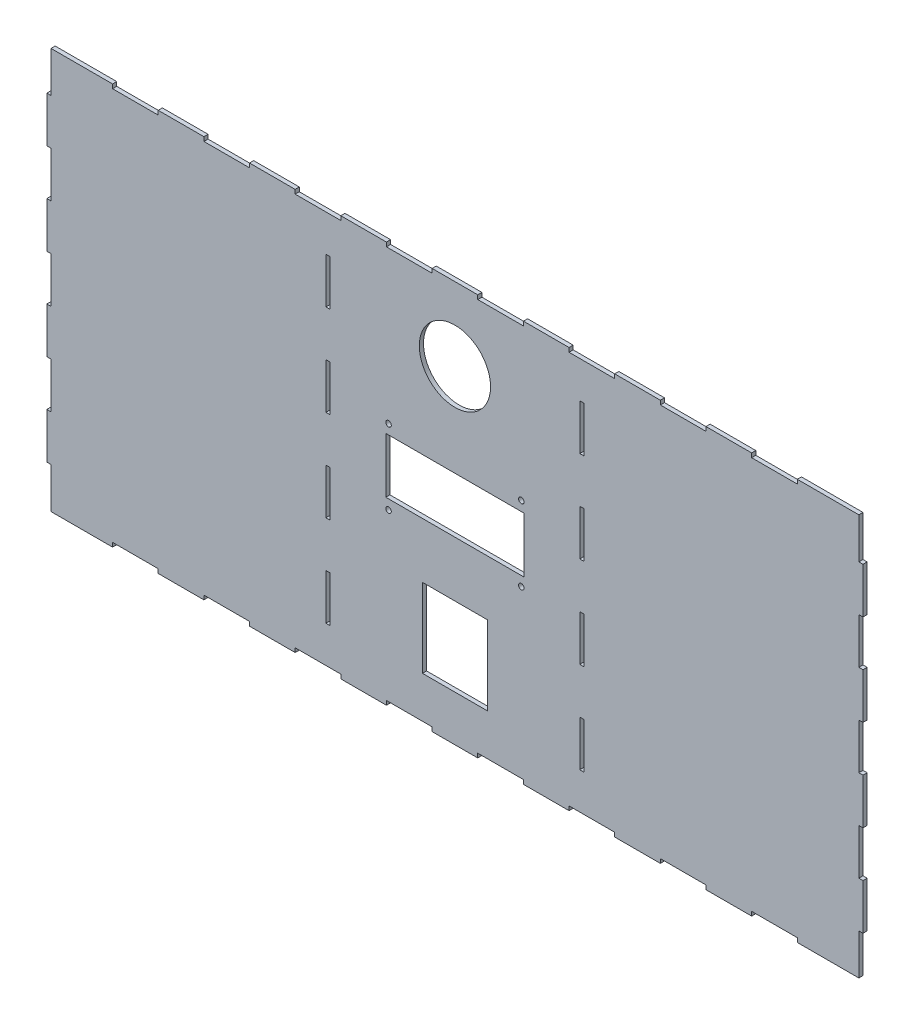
SolidWorks part; units mm, degrees
ref_plane "Front Plane" through (0, 0, 0) normal (0, 0, 1) x (1, 0, 0)
ref_plane "Top Plane" through (0, 0, 0) normal (0, 1, 0) x (1, 0, 0)
ref_plane "Right Plane" through (0, 0, 0) normal (1, 0, 0) x (0, 0, -1)
sketch "Sketch1" plane through (0, 0, 0) normal (0, 0, 1) x (1, 0, 0)
  line L0 (296, 586) -> (296, 556.5)
  line L1 (296, 556.5) -> (293, 556.5)
  line L2 (293, 556.5) -> (293, 523.5)
  line L3 (293, 523.5) -> (296, 523.5)
  line L4 (296, 523.5) -> (296, 490.5)
  line L5 (296, 490.5) -> (293, 490.5)
  line L6 (293, 490.5) -> (293, 457.5)
  line L7 (293, 457.5) -> (296, 457.5)
  line L8 (296, 457.5) -> (296, 424.5)
  line L9 (296, 424.5) -> (293, 424.5)
  line L10 (293, 424.5) -> (293, 391.5)
  line L11 (293, 391.5) -> (296, 391.5)
  line L12 (296, 391.5) -> (296, 358.5)
  line L13 (296, 358.5) -> (293, 358.5)
  line L14 (293, 358.5) -> (293, 325.5)
  line L15 (293, 325.5) -> (296, 325.5)
  line L16 (296, 325.5) -> (296, 296)
  line L17 (296, 296) -> (340.5, 296)
  line L18 (340.5, 296) -> (340.5, 299)
  line L19 (340.5, 299) -> (373.5, 299)
  line L20 (373.5, 299) -> (373.5, 296)
  line L21 (373.5, 296) -> (406.5, 296)
  line L22 (406.5, 296) -> (406.5, 299)
  line L23 (406.5, 299) -> (439.5, 299)
  line L24 (439.5, 299) -> (439.5, 296)
  line L25 (439.5, 296) -> (472.5, 296)
  line L26 (472.5, 296) -> (472.5, 299)
  line L27 (472.5, 299) -> (505.5, 299)
  line L28 (505.5, 299) -> (505.5, 296)
  line L29 (505.5, 296) -> (538.5, 296)
  line L30 (538.5, 296) -> (538.5, 299)
  line L31 (538.5, 299) -> (571.5, 299)
  line L32 (571.5, 299) -> (571.5, 296)
  line L33 (571.5, 296) -> (604.5, 296)
  line L34 (604.5, 296) -> (604.5, 299)
  line L35 (604.5, 299) -> (637.5, 299)
  line L36 (637.5, 299) -> (637.5, 296)
  line L37 (637.5, 296) -> (670.5, 296)
  line L38 (670.5, 296) -> (670.5, 299)
  line L39 (670.5, 299) -> (703.5, 299)
  line L40 (703.5, 299) -> (703.5, 296)
  line L41 (703.5, 296) -> (736.5, 296)
  line L42 (736.5, 296) -> (736.5, 299)
  line L43 (736.5, 299) -> (769.5, 299)
  line L44 (769.5, 299) -> (769.5, 296)
  line L45 (769.5, 296) -> (802.5, 296)
  line L46 (802.5, 296) -> (802.5, 299)
  line L47 (802.5, 299) -> (835.5, 299)
  line L48 (835.5, 299) -> (835.5, 296)
  line L49 (835.5, 296) -> (868.5, 296)
  line L50 (868.5, 296) -> (880, 296)
  line L51 (880, 296) -> (880, 325.5)
  line L52 (880, 325.5) -> (883, 325.5)
  line L53 (883, 325.5) -> (883, 358.5)
  line L54 (883, 358.5) -> (880, 358.5)
  line L55 (880, 358.5) -> (880, 391.5)
  line L56 (880, 391.5) -> (883, 391.5)
  line L57 (883, 391.5) -> (883, 424.5)
  line L58 (883, 424.5) -> (880, 424.5)
  line L59 (880, 424.5) -> (880, 457.5)
  line L60 (880, 457.5) -> (883, 457.5)
  line L61 (883, 457.5) -> (883, 490.5)
  line L62 (883, 490.5) -> (880, 490.5)
  line L63 (880, 490.5) -> (880, 523.5)
  line L64 (880, 523.5) -> (883, 523.5)
  line L65 (883, 523.5) -> (883, 556.5)
  line L66 (883, 556.5) -> (880, 556.5)
  line L67 (880, 556.5) -> (880, 586)
  line L68 (880, 586) -> (835.5, 586)
  line L69 (835.5, 586) -> (835.5, 583)
  line L70 (835.5, 583) -> (802.5, 583)
  line L71 (802.5, 583) -> (802.5, 586)
  line L72 (802.5, 586) -> (769.5, 586)
  line L73 (769.5, 586) -> (769.5, 583)
  line L74 (769.5, 583) -> (736.5, 583)
  line L75 (736.5, 583) -> (736.5, 586)
  line L76 (736.5, 586) -> (703.5, 586)
  line L77 (703.5, 586) -> (703.5, 583)
  line L78 (703.5, 583) -> (670.5, 583)
  line L79 (670.5, 583) -> (670.5, 586)
  line L80 (670.5, 586) -> (637.5, 586)
  line L81 (637.5, 586) -> (637.5, 583)
  line L82 (637.5, 583) -> (604.5, 583)
  line L83 (604.5, 583) -> (604.5, 586)
  line L84 (604.5, 586) -> (571.5, 586)
  line L85 (571.5, 586) -> (571.5, 583)
  line L86 (571.5, 583) -> (538.5, 583)
  line L87 (538.5, 583) -> (538.5, 586)
  line L88 (538.5, 586) -> (505.5, 586)
  line L89 (505.5, 586) -> (505.5, 583)
  line L90 (505.5, 583) -> (472.5, 583)
  line L91 (472.5, 583) -> (472.5, 586)
  line L92 (472.5, 586) -> (439.5, 586)
  line L93 (439.5, 586) -> (439.5, 583)
  line L94 (439.5, 583) -> (406.5, 583)
  line L95 (406.5, 583) -> (406.5, 586)
  line L96 (406.5, 586) -> (373.5, 586)
  line L97 (373.5, 586) -> (373.5, 583)
  line L98 (373.5, 583) -> (340.5, 583)
  line L99 (340.5, 583) -> (340.5, 586)
  line L100 (340.5, 586) -> (307.5, 586)
  line L101 (307.5, 586) -> (296, 586)
  line L102 (494.75, 556.5) -> (497.75, 556.5)
  line L103 (538, 466) -> (638, 466)
  line L104 (538, 466) -> (538, 426)
  line L105 (538, 426) -> (638, 426)
  line L106 (638, 466) -> (638, 426)
  line L107 (678.25, 556.5) -> (681.25, 556.5)
  line L108 (678.25, 556.5) -> (678.25, 523.5)
  line L109 (678.25, 523.5) -> (681.25, 523.5)
  line L110 (681.25, 556.5) -> (681.25, 523.5)
  line L111 (678.25, 490.5) -> (681.25, 490.5)
  line L112 (678.25, 490.5) -> (678.25, 457.5)
  line L113 (678.25, 457.5) -> (681.25, 457.5)
  line L114 (681.25, 490.5) -> (681.25, 457.5)
  line L115 (678.25, 424.5) -> (681.25, 424.5)
  line L116 (678.25, 424.5) -> (678.25, 391.5)
  line L117 (678.25, 391.5) -> (681.25, 391.5)
  line L118 (681.25, 424.5) -> (681.25, 391.5)
  line L119 (678.25, 358.5) -> (681.25, 358.5)
  line L120 (678.25, 358.5) -> (678.25, 325.5)
  line L121 (678.25, 325.5) -> (681.25, 325.5)
  line L122 (681.25, 358.5) -> (681.25, 325.5)
  line L123 (494.75, 556.5) -> (494.75, 523.5)
  line L124 (494.75, 523.5) -> (497.75, 523.5)
  line L125 (497.75, 556.5) -> (497.75, 523.5)
  line L126 (494.75, 490.5) -> (497.75, 490.5)
  line L127 (494.75, 490.5) -> (494.75, 457.5)
  line L128 (494.75, 457.5) -> (497.75, 457.5)
  line L129 (497.75, 490.5) -> (497.75, 457.5)
  line L130 (494.75, 424.5) -> (497.75, 424.5)
  line L131 (494.75, 424.5) -> (494.75, 391.5)
  line L132 (494.75, 391.5) -> (497.75, 391.5)
  line L133 (497.75, 424.5) -> (497.75, 391.5)
  line L134 (494.75, 358.5) -> (497.75, 358.5)
  line L135 (494.75, 358.5) -> (494.75, 325.5)
  line L136 (494.75, 325.5) -> (497.75, 325.5)
  line L137 (497.75, 358.5) -> (497.75, 325.5)
  line L139 (564.5, 386) -> (611.5, 386)
  line L140 (564.5, 386) -> (564.5, 329)
  line L141 (564.5, 329) -> (611.5, 329)
  line L142 (611.5, 386) -> (611.5, 329)
  circle A0 centre (588, 533) radius 25.75
  circle A1 centre (636, 473) radius 2
  circle A2 centre (540, 473) radius 2
  circle A3 centre (540, 419) radius 2
  circle A4 centre (636, 419) radius 2
  dimension "D43" = 51.5
  dimension "D44" = 50
  dimension "D45" = 50
  dimension "D46" = 4
  dimension "D49" = 4
  dimension "D52" = 4
  dimension "D55" = 4
  dimension "D1" = 293
  dimension "D2" = 296
  dimension "D3" = 307.5
  dimension "D4" = 340.5
  dimension "D5" = 296
  dimension "D6" = 325.5
  dimension "D7" = 100
  dimension "D8" = 40
  dimension "D9" = 33
  dimension "D10" = 33
  dimension "D11" = 33
  dimension "D12" = 33
  dimension "D13" = 33
  dimension "D14" = 33
  dimension "D15" = 33
  dimension "D16" = 26.5
  dimension "D17" = 3
  dimension "D18" = 3
  dimension "D19" = 3
  dimension "D20" = 3
  dimension "D21" = 198.75
  dimension "D22" = 198.75
  dimension "D23" = 198.75
  dimension "D24" = 198.75
  dimension "D25" = 33
  dimension "D26" = 33
  dimension "D27" = 33
  dimension "D28" = 33
  dimension "D29" = 33
  dimension "D30" = 33
  dimension "D31" = 33
  dimension "D32" = 3
  dimension "D33" = 3
  dimension "D34" = 3
  dimension "D35" = 3
  dimension "D36" = 198.75
  dimension "D37" = 198.75
  dimension "D38" = 198.75
  dimension "D39" = 198.75
  dimension "D40" = 26.5
  dimension "D41" = 40.25
  dimension "D42" = 120
  dimension "D47" = 2
  dimension "D48" = 7
  dimension "D50" = 7
  dimension "D51" = 2
  dimension "D53" = 2
  dimension "D54" = 7
  dimension "D56" = 2
  dimension "D57" = 7
  dimension "D58" = 57
  dimension "D59" = 47
  dimension "D60" = 66.75
  dimension "D61" = 40
extrude "Boss-Extrude1" add sketch "Sketch1" along normal blind 3
